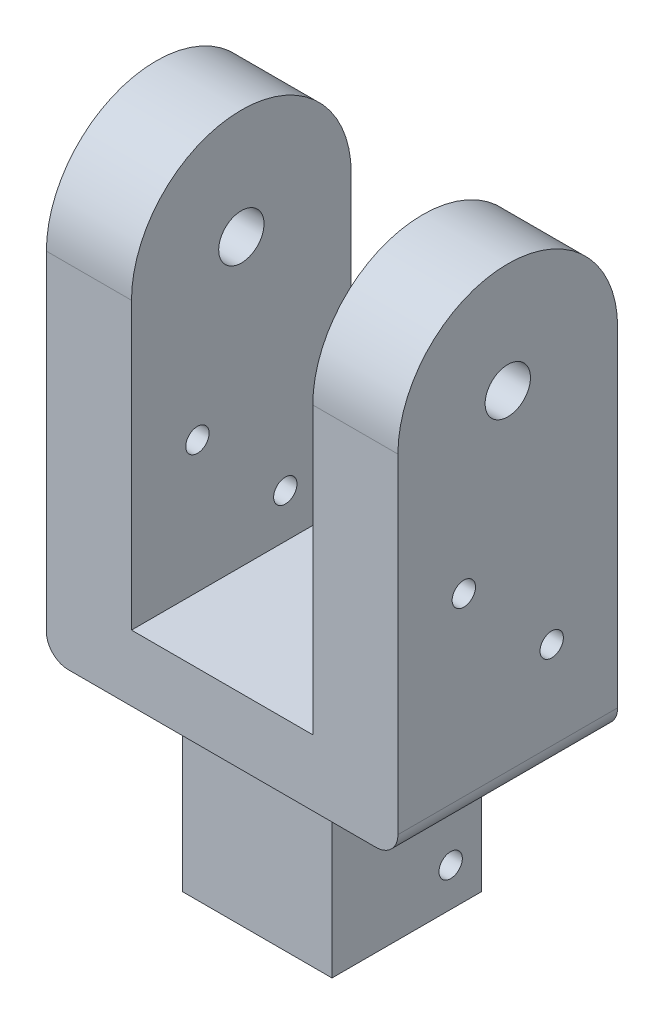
SolidWorks part; units mm, degrees
ref_plane "Front" through (0, 0, 0) normal (0, 0, 1) x (1, 0, 0)
ref_plane "Top" through (0, 0, 0) normal (0, 1, 0) x (1, 0, 0)
ref_plane "Right" through (0, 0, 0) normal (1, 0, 0) x (0, 0, -1)
sketch "Sketch1" plane through (0, 0, 0) normal (1, 0, 0) x (0, 0, -1)
  line L2 (31.75, 0) -> (31.75, -152.4)
  line L3 (31.75, -152.4) -> (-31.75, -152.4)
  line L4 (-31.75, 0) -> (-31.75, -152.4)
  circle A0 centre (0, 0) radius 6.5481
  arc A1 (31.75, 0) -> (-31.75, 0) centre (0, 0) ccw
  dimension "D1" = 13.0962
  dimension "D2" = 63.5
  dimension "D3" = 152.4
extrude "Extrude1" add sketch "Sketch1" along normal blind 101.6
sketch "Sketch2" plane through (0, -152.4, 0) normal (0, -1, 0) x (1, 0, 0)
  line L0 (101.6, 0) -> (0, 0) construction
  line L1 (101.6, 31.75) -> (101.6, -31.75) construction
  line L2 (50.8, -31.75) -> (50.8, 31.75) construction
  line L3 (101.6, -31.75) -> (0, -31.75) construction
  line L4 (101.6, 31.75) -> (0, 31.75) construction
  line L6 (29.21, 21.59) -> (72.39, 21.59)
  line L7 (29.21, 21.59) -> (29.21, -21.59)
  line L8 (29.21, -21.59) -> (72.39, -21.59)
  line L9 (72.39, 21.59) -> (72.39, -21.59)
  line L10 (-16.5907, 48.6147) -> (110.6996, 48.6147)
  line L11 (-16.5907, 48.6147) -> (-16.5907, -43.0907)
  line L12 (-16.5907, -43.0907) -> (110.6996, -43.0907)
  line L13 (110.6996, 48.6147) -> (110.6996, -43.0907)
  dimension "D1" = 43.18
  dimension "D2" = 43.18
  dimension "D3" = 21.59
  dimension "D4" = 21.59
extrude "Cut-Extrude1" cut sketch "Sketch2" against normal blind 50.8
sketch "Sketch3" plane through (0, 0, 31.75) normal (0, 0, 1) x (1, 0, 0)
  line L0 (50.8, -101.6) -> (50.8, 44.3372) construction
  line L1 (72.39, -101.6) -> (29.21, -101.6) construction
  line L2 (101.6, 31.75) -> (0, 31.75) construction
  line L3 (24.6063, 35.6917) -> (76.9938, 35.6917)
  line L4 (24.6063, 35.6917) -> (24.6063, -82.55)
  line L5 (24.6063, -82.55) -> (76.9938, -82.55)
  line L6 (76.9938, 35.6917) -> (76.9938, -82.55)
  dimension "D1" = 114.3
  dimension "D2" = 26.1937
  dimension "D3" = 52.3875
extrude "Cut-Extrude2" cut sketch "Sketch3" against normal through all
sketch "Sketch5" plane through (29.21, 0, 0) normal (-1, 0, 0) x (0, 0, 1)
  line L0 (21.59, -101.6) -> (-21.59, -101.6) construction
  line L2 (31.75, -101.6) -> (-31.75, -101.6) construction
  line L3 (0, 0) -> (0, -152.4) construction
  line L4 (21.59, -152.4) -> (-21.59, -152.4) construction
  circle A0 centre (12.7, -114.3) radius 3.3731
  circle A1 centre (-12.7, -139.7) radius 3.3731
  dimension "D1" = 6.7462
  dimension "D3" = 12.7
  dimension "D4" = 12.7
  dimension "D2" = 12.7
  dimension "D5" = 38.1
extrude "Cut-Extrude3" cut sketch "Sketch5" against normal through all
fillet "Fillet1" radius 6.35 2 edges at (101.6, -101.6, 0) (0, -101.6, 0)
chamfer "Chamfer1" distance 1.5875 angle 45 4 edges at (50.8, -152.4, 21.59) (72.39, -152.4, 0) (50.8, -152.4, -21.59) (29.21, -152.4, 0)
sketch "Sketch6" plane through (0, 0, 0) normal (-1, 0, 0) x (0, 0, 1)
  circle A1 centre (12.7, -44.45) radius 3.3731
  circle A2 centre (-12.7, -69.85) radius 3.3731
extrude "Cut-Extrude4" cut sketch "Sketch6" against normal through all
